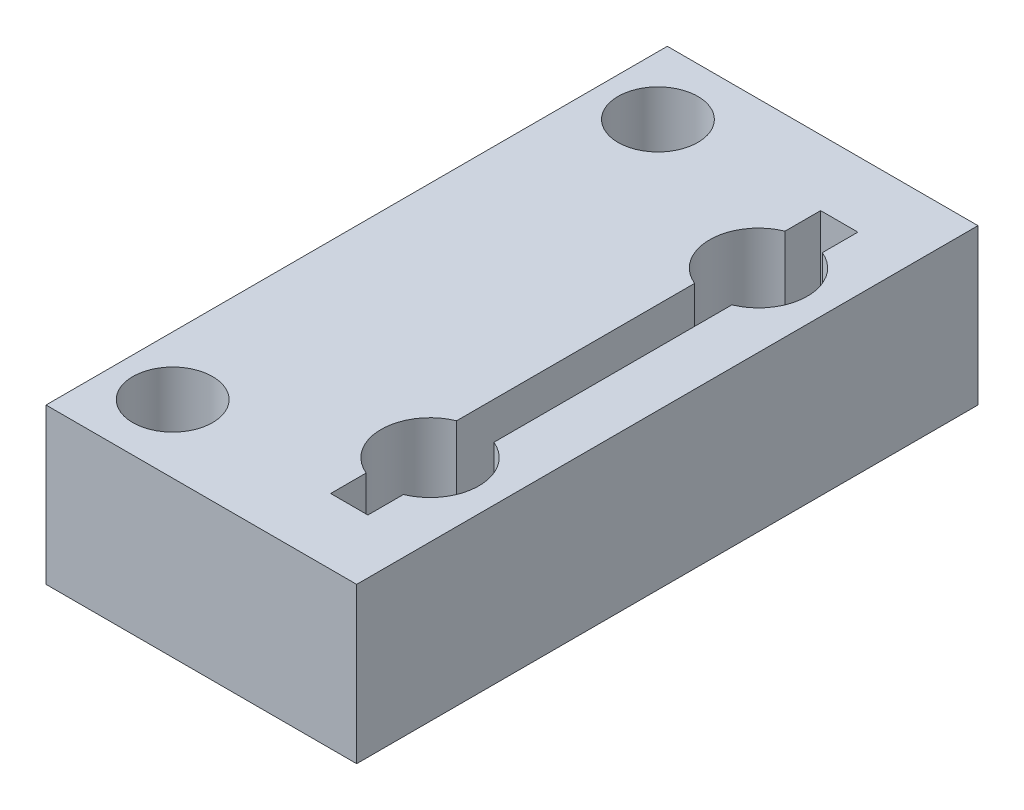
SolidWorks part; units mm, degrees
ref_plane "Front/Back" through (0, 0, 0) normal (0, 0, 1) x (1, 0, 0)
ref_plane "Top/Bottom" through (0, 0, 0) normal (0, 1, 0) x (1, 0, 0)
ref_plane "Right/Left" through (0, 0, 0) normal (1, 0, 0) x (0, 0, -1)
sketch "Sketch1" plane through (0, 0, 0) normal (0, 1, 0) x (1, 0, 0)
  line L0 (0, 0) -> (6.35, 0) construction
  line L1 (-6.35, 12.7) -> (6.35, 12.7)
  line L2 (-6.35, 12.7) -> (-6.35, -12.7)
  line L3 (-6.35, -12.7) -> (6.35, -12.7)
  line L4 (6.35, 12.7) -> (6.35, -12.7)
  line L5 (0, 0) -> (0, 12.7) construction
  dimension "D1" = 12.7
  dimension "D2" = 25.4
extrude "Extrude1" add sketch "Sketch1" along normal mid plane 6.35
sketch "Sketch3" plane through (0, 3.175, 0) normal (0, 1, 0) x (-1, 0, 0)
  line L0 (-3.3629, 6.7132) -> (-3.3629, -6.7132) construction
  line L1 (-4.1249, 10.0152) -> (-2.6009, 10.0152)
  line L2 (-4.1249, 10.0152) -> (-4.1249, 8.5624)
  line L3 (-4.1249, -10.0152) -> (-2.6009, -10.0152)
  line L4 (-2.6009, 10.0152) -> (-2.6009, 8.5624)
  line L5 (-4.1249, 4.8641) -> (-4.1249, -4.8641)
  line L6 (-2.6009, 4.8641) -> (-2.6009, -4.8641)
  line L7 (-4.1249, -8.5624) -> (-4.1249, -10.0152)
  line L8 (-2.6009, -8.5624) -> (-2.6009, -10.0152)
  line L9 (6.35, 12.7) -> (-6.35, 12.7) construction
  line L10 (-6.35, 12.7) -> (-6.35, -12.7) construction
  arc A0 (-4.1249, 8.5624) -> (-4.1249, 4.8641) centre (-3.3629, 6.7132) ccw
  arc A1 (-4.1249, -4.8641) -> (-4.1249, -8.5624) centre (-3.3629, -6.7132) ccw
  arc A2 (-2.6009, 4.8641) -> (-2.6009, 8.5624) centre (-3.3629, 6.7132) ccw
  arc A3 (-2.6009, -8.5624) -> (-2.6009, -4.8641) centre (-3.3629, -6.7132) ccw
  dimension "D1" = 4
  dimension "D5" = 5.9868
  dimension "D6" = 13.4264
  dimension "D7" = 2.9871
  dimension "D2" = 3.302
  dimension "D3" = 3.302
  dimension "D4" = 1.524
extrude "Cut-Extrude1" cut sketch "Sketch3" against normal through all
hole_wizard "#4 Clearance Hole1" positions "Sketch5" profile "Sketch4" hole size "#4" standard "Ansi Inch"
sketch "Sketch5" plane through (0, 3.175, 0) normal (0, 1, 0) x (-1, 0, 0)
  line L0 (6.35, 12.7) -> (-6.35, 12.7) construction
  line L1 (-6.35, -12.7) -> (6.35, -12.7) construction
  line L2 (6.35, -12.7) -> (6.35, 12.7) construction
  point P0 (3.9523, 9.9187)
  point P1 (3.9523, -9.9187)
  dimension "D1" = 2.7813
  dimension "D2" = 2.7813
  dimension "D3" = 2.3977
sketch "Sketch4" plane through (-3.9523, 3.175, 9.9187) normal (1, 0, 0) x (0, 0, 1)
  line L0 (0, 0) -> (0, 6.35)
  line L1 (0, 6.35) -> (1.6319, 6.35)
  line L2 (1.6319, 6.35) -> (1.6319, 0)
  line L5 (1.6319, 0) -> (0, 0)
  line L11 (0, -6.35) -> (0, 107.95) construction
  dimension "Thru Hole Dia." = 3.2639
  dimension "Thru Hole Depth" = 6.35
